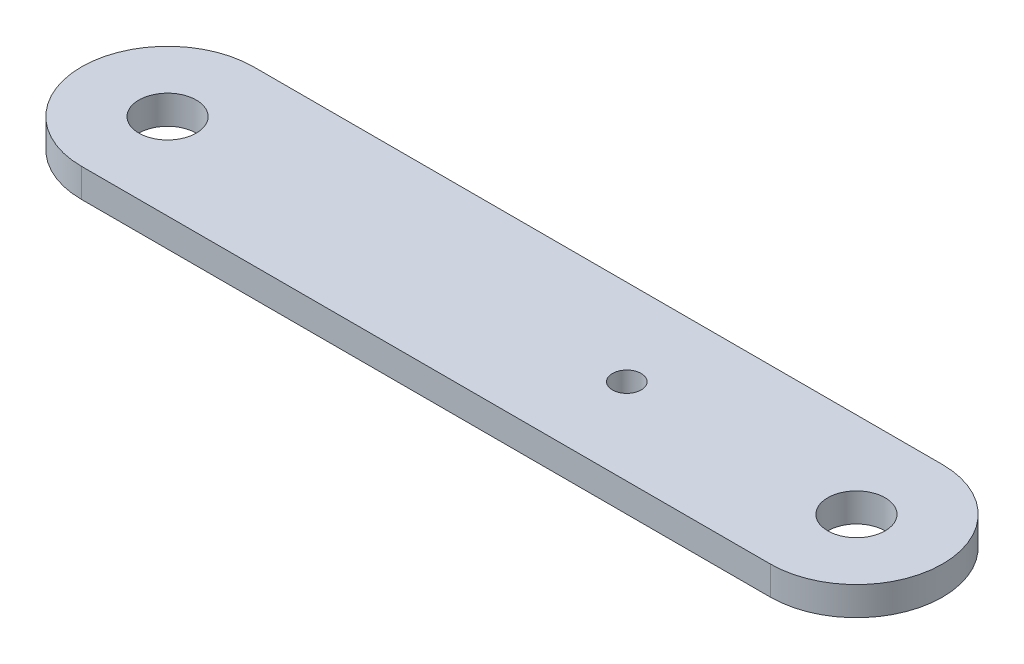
SolidWorks part; units mm, degrees
ref_plane "Front Plane" through (0, 0, 0) normal (0, 0, 1) x (1, 0, 0)
ref_plane "Top Plane" through (0, 0, 0) normal (0, 1, 0) x (1, 0, 0)
ref_plane "Right Plane" through (0, 0, 0) normal (1, 0, 0) x (0, 0, -1)
sketch "Sketch1" plane through (0, 0, 0) normal (0, 1, 0) x (1, 0, 0)
  line L1 (-76.2, -19.05) -> (76.2, -19.05)
  line L3 (-76.2, 19.05) -> (76.2, 19.05)
  line L5 (-76.2, -19.05) -> (76.2, 19.05) construction
  line L6 (-76.2, 19.05) -> (76.2, -19.05) construction
  arc A0 (-76.2, 19.05) -> (-76.2, -19.05) centre (-76.2, 0) ccw
  arc A1 (76.2, 19.05) -> (76.2, -19.05) centre (76.2, 0) cw
  point P0 (0, 0)
  dimension "D1" = 152.4
  dimension "D2" = 38.1
extrude "Boss-Extrude1" add sketch "Sketch1" along normal mid plane 6.35
sketch "Sketch2" plane through (0, 3.175, 0) normal (0, 1, 0) x (1, 0, 0)
  line L0 (0, -19.05) -> (0, 19.05) construction
  line L1 (-76.2, -19.05) -> (76.2, -19.05) construction
  line L2 (-76.2, 19.05) -> (76.2, 19.05) construction
  line L3 (25.4, 0) -> (76.2, 0) construction
  circle A0 centre (-76.2, 0) radius 6.35
  circle A1 centre (76.2, 0) radius 6.35
  circle A2 centre (25.4, 0) radius 3.175
  dimension "D1" = 12.7
  dimension "D2" = 12.7
  dimension "D4" = 6.35
  dimension "D3" = 50.8
extrude "Cut-Extrude1" cut sketch "Sketch2" along direction (0, -1, 0) on the side against the normal through all
